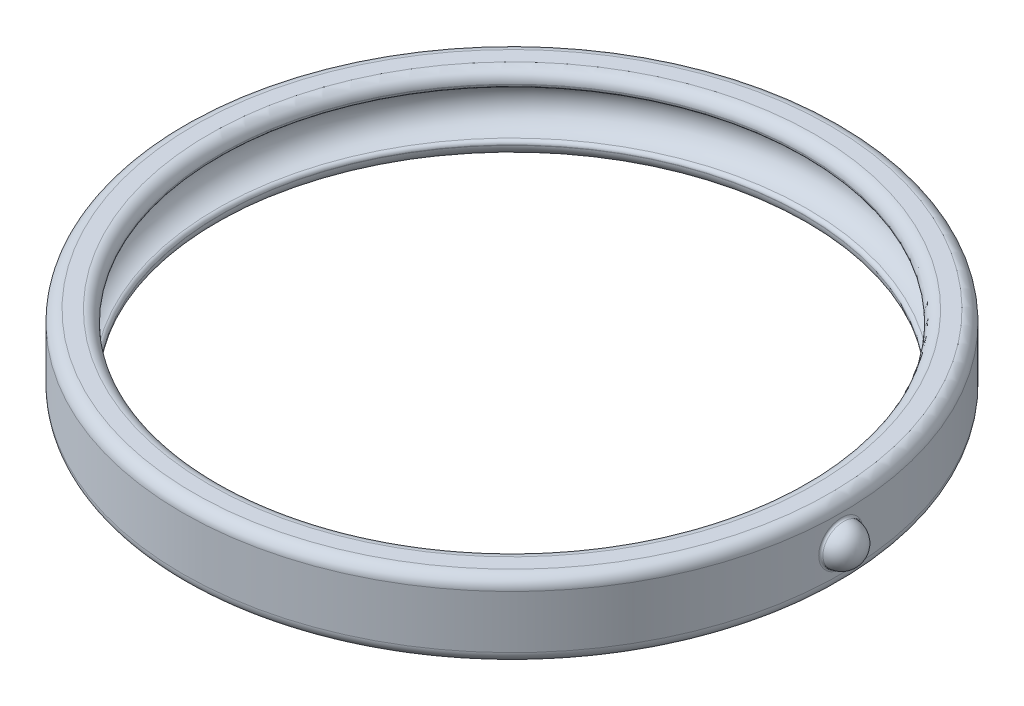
SolidWorks part; units mm, degrees
ref_plane "前视基准面" through (0, 0, 0) normal (0, 0, 1) x (1, 0, 0)
ref_plane "上视基准面" through (0, 0, 0) normal (0, 1, 0) x (1, 0, 0)
ref_plane "右视基准面" through (0, 0, 0) normal (1, 0, 0) x (0, 0, -1)
sketch "草图1" plane through (0, 0, 0) normal (0, 0, 1) x (1, 0, 0)
  line L0 (0, 0) -> (0, 47.0541) construction
  line L1 (38.6, 8.4641) -> (38.6, 8.5)
  line L2 (40.1, 0) -> (42.1, 0)
  line L3 (38.6, 1.5) -> (38.6, 1.5359)
  line L4 (40.1, 10) -> (42.1, 10)
  line L5 (43.6, 1.5) -> (43.6, 8.5)
  arc A0 (39.0286, 2.0308) -> (39.0286, 7.9692) centre (38.6, 5) ccw
  arc A1 (38.6, 8.5) -> (40.1, 10) centre (40.1, 8.5) cw
  arc A2 (40.1, 0) -> (38.6, 1.5) centre (40.1, 1.5) cw
  arc A3 (42.1, 0) -> (43.6, 1.5) centre (42.1, 1.5) ccw
  arc A4 (42.1, 10) -> (43.6, 8.5) centre (42.1, 8.5) cw
  arc A5 (39.0286, 7.9692) -> (38.6, 8.4641) centre (39.1, 8.4641) cw
  arc A6 (39.0286, 2.0308) -> (38.6, 1.5359) centre (39.1, 1.5359) ccw
  point P12 (38.6, 10)
  point P17 (43.6, 0)
  point P20 (43.6, 10)
  point P23 (38.6, 8)
revolve "旋转1" add sketch "草图1" angle 360 about L0
sketch "草图2" plane through (0, 0, 0) normal (0, 0, 1) x (1, 0, 0)
  line L0 (43.6, 1.5) -> (43.6, 8.5) construction
  line L1 (43.6, 5) -> (43.6, -0.5229) construction
  line L2 (43.6, 7.65) -> (43.6, 2.35)
  arc A0 (43.6, 2.35) -> (43.6, 7.65) centre (43.6, 5) ccw
  dimension "D1" = 5.3
revolve "旋转4" add sketch "草图2" angle 110 about L1
sketch "草图3" plane through (0, 0, 0) normal (0, 0, 1) x (1, 0, 0)
  line L0 (-43.6, 8.5) -> (-43.6, 1.5) construction
  line L1 (-43.6, 7.65) -> (-43.6, 2.35)
  line L2 (-43.6, 7.65) -> (-43.6, -1.9068) construction
  arc A0 (-43.6, 7.65) -> (-43.6, 2.35) centre (-43.6, 5) ccw
  dimension "D1" = 5.3
revolve "旋转5" add sketch "草图3" angle 110 about L2
fillet "圆角2" radius 0.3 2 edges at (43.5237, 4.396, 2.5791) (-43.5237, 4.396, -2.5791)
equation "\"len1\"=43.6"
equation "\"len2\"= 45"
equation "\"len3\"= 40"
equation "\"D1@草图1\"=\"len1\""
